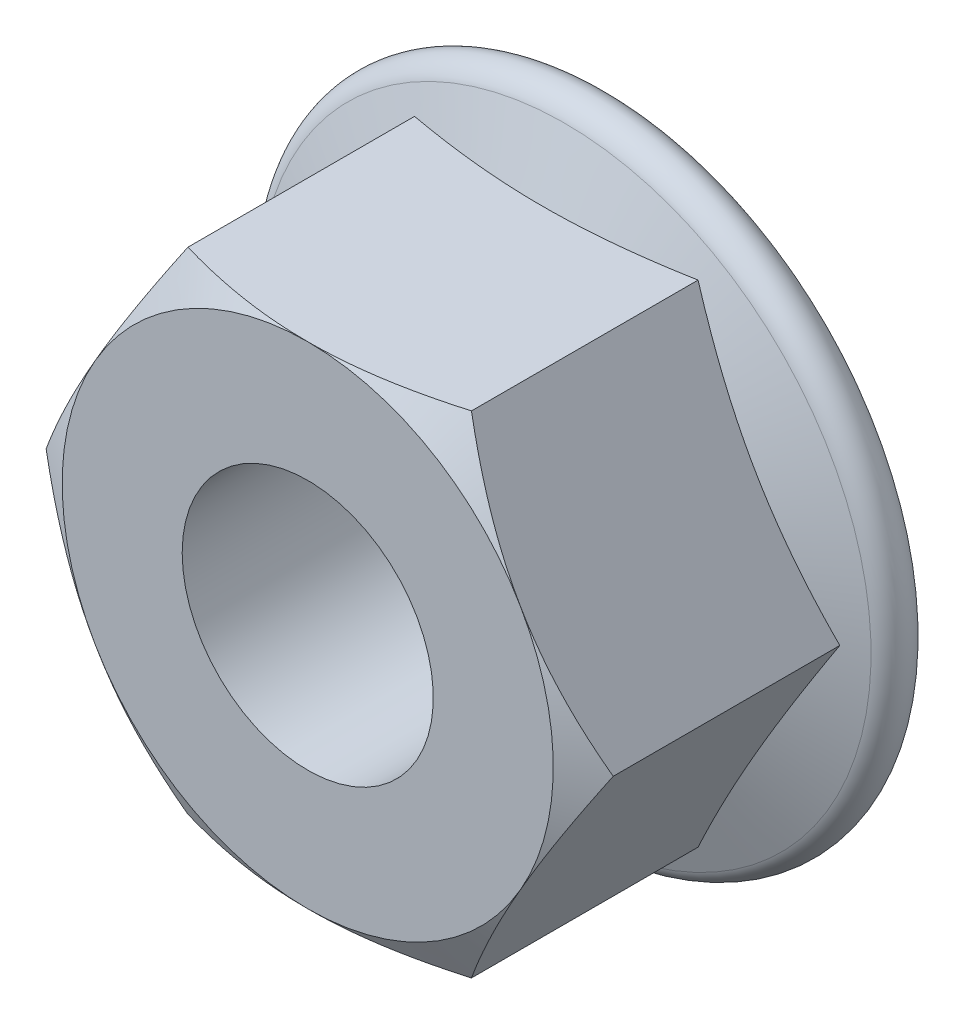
SolidWorks part; units mm, degrees
ref_plane "Plan1" through (0, 0, 0) normal (0, 0, 1) x (1, 0, 0)
ref_plane "Plan2" through (0, 0, 0) normal (0, 1, 0) x (1, 0, 0)
ref_plane "Plan3" through (0, 0, 0) normal (1, 0, 0) x (0, 0, -1)
sketch "Sketch1" plane through (0, 0, 0) normal (0, 0, 1) x (1, 0, 0)
  line L0 (-7.5056, 0) -> (7.5056, 0) construction
  line L1 (0, 6.5) -> (0, -6.5) construction
  line L2 (-3.7528, 6.5) -> (3.7528, 6.5)
  line L3 (3.7528, 6.5) -> (7.5056, 0)
  line L4 (7.5056, 0) -> (3.7528, -6.5)
  line L5 (3.7528, -6.5) -> (-3.7528, -6.5)
  line L6 (-3.7528, -6.5) -> (-7.5056, 0)
  line L7 (-7.5056, 0) -> (-3.7528, 6.5)
  dimension "D1" = 120
  dimension "S" = 13
extrude "Base-Extrude" add sketch "Sketch1" along normal blind 8
sketch "Sketch2" plane through (0, 0, 0) normal (0, 1, 0) x (1, 0, 0)
  line L0 (0, 0) -> (0, -8) construction
  line L1 (3.7528, -8) -> (-3.7528, -8) construction
  line L2 (3.7528, 0) -> (-3.7528, 0) construction
  line L3 (-7.5056, -7.4194) -> (-7.5056, -8)
  line L4 (-7.5056, -8) -> (-7.5056, 0) construction
  line L5 (-7.5056, -8) -> (-6.5, -8)
  line L6 (-3.7528, -8) -> (-7.5056, -8) construction
  line L7 (-6.5, -8) -> (-7.5056, -7.4194)
  line L8 (0, 0) -> (0, -1.25) construction
  dimension "D2" = 30
  dimension "P" = 1.25
revolve "Cut-Revolve1" cut sketch "Sketch2" angle 360 about L0
sketch "Sketch3" plane through (0, 0, 0) normal (1, 0, 0) x (0, 0, -1)
  line L0 (-8, 0) -> (0, 0) construction
  line L1 (0, 0) -> (-8, 0) construction
  line L2 (0, 6.5) -> (0, 7.9)
  line L3 (0, 6.5) -> (-1.7866, 6.5)
  line L5 (-7.4194, 6.5) -> (0, 6.5) construction
  line L6 (-1.7866, 6.5) -> (-1.2, 8.1116)
  arc A0 (0, 7.9) -> (-1.2, 8.1116) centre (-0.6187, 7.9) ccw
  dimension "D1" = 20
  dimension "DW" = 15.8
  dimension "C" = 1.2
revolve "Boss-Revolve1" add sketch "Sketch3" angle 360 about L0
other "Hole1"
sketch "Sketch4" plane through (0, 0, 0) normal (0, 0, -1) x (-1, 0, 0)
  circle A0 centre (0, 0) radius 3.3234
  circle A1 centre (0, 0) radius 7.9 construction
  dimension "D1" = 6.6469
sketch "Esquisse1" plane through (0, 0, 8) normal (0, 0, 1) x (1, 0, 0)
  circle A0 centre (0, 0) radius 4
  dimension "D1" = 8
extrude "DRW" cut sketch "Esquisse1" against normal through all
equation "\"D1@Sketch4\" = \"D@Cosmetic_Thread1\"-(1.0825*\"P@Sketch2\")"
